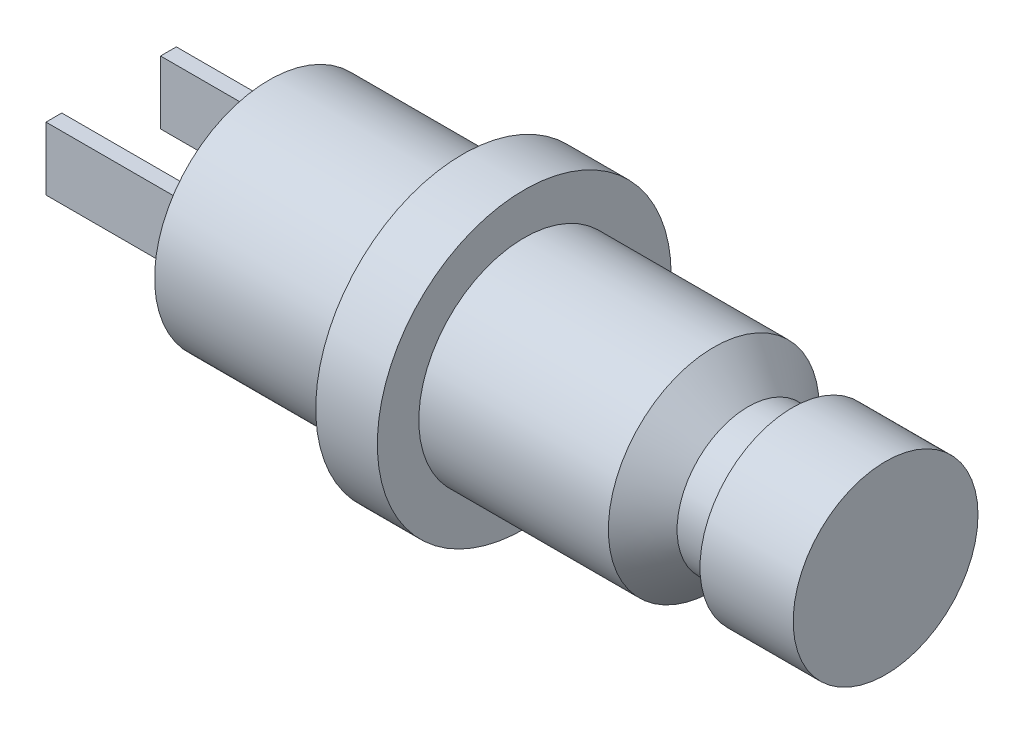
SolidWorks part; units mm, degrees
ref_plane "Front Plane" through (0, 0, 0) normal (0, 0, 1) x (1, 0, 0)
ref_plane "Top Plane" through (0, 0, 0) normal (0, 1, 0) x (1, 0, 0)
ref_plane "Right Plane" through (0, 0, 0) normal (1, 0, 0) x (0, 0, -1)
sketch "Sketch1" plane through (0, 0, 0) normal (0, 0, 1) x (1, 0, 0)
  line L0 (0, 0) -> (-28.4694, 0) construction
  line L1 (0, 3.683) -> (6.223, 3.683)
  line L2 (6.223, 3.683) -> (6.223, 4.7244)
  line L3 (6.223, 4.7244) -> (8.2042, 4.7244)
  line L4 (8.2042, 4.7244) -> (8.2042, 3.3909)
  line L5 (8.2042, 3.3909) -> (14.3002, 3.3909)
  line L6 (14.3002, 3.3909) -> (15.4051, 2.286)
  line L7 (16.8275, 2.9718) -> (19.8247, 2.9718)
  line L8 (19.8247, 2.9718) -> (19.8247, 0)
  line L9 (19.8247, 0) -> (0, 0)
  line L10 (0, 3.683) -> (0, 0)
  line L11 (16.8275, 2.9718) -> (16.8275, 2.286)
  line L12 (16.8275, 2.286) -> (15.4051, 2.286)
  dimension "D1" = 7.366
  dimension "D2" = 6.223
  dimension "D3" = 9.4488
  dimension "D4" = 1.9812
  dimension "D5" = 6.7818
  dimension "D6" = 6.096
  dimension "D7" = 19.8247
  dimension "D8" = 5.9436
  dimension "D9" = 4.572
  dimension "D10" = 2.9972
  dimension "D11" = 45
revolve "Revolve1" add sketch "Sketch1" angle 360 about L0
sketch "Sketch2" plane through (0, 0, 0) normal (-1, 0, 0) x (0, 0, 1)
  line L0 (0, 0) -> (-1.8415, 0) construction
  line L1 (0, 0) -> (1.8415, 0) construction
  line L3 (-2.0955, -1.016) -> (-1.5875, -1.016)
  line L4 (-2.0955, -1.016) -> (-2.0955, 1.016)
  line L5 (-2.0955, 1.016) -> (-1.5875, 1.016)
  line L6 (-1.5875, -1.016) -> (-1.5875, 1.016)
  line L7 (-2.0955, -1.016) -> (-1.5875, 1.016) construction
  line L8 (-2.0955, 1.016) -> (-1.5875, -1.016) construction
  line L9 (2.0955, -1.016) -> (1.5875, -1.016)
  line L10 (2.0955, -1.016) -> (2.0955, 1.016)
  line L11 (2.0955, 1.016) -> (1.5875, 1.016)
  line L12 (1.5875, -1.016) -> (1.5875, 1.016)
  line L13 (2.0955, -1.016) -> (1.5875, 1.016) construction
  line L14 (2.0955, 1.016) -> (1.5875, -1.016) construction
  dimension "D1" = 2.032
  dimension "D2" = 0.508
  dimension "D3" = 3.175
extrude "Boss-Extrude1" add sketch "Sketch2" along normal blind 5.08
